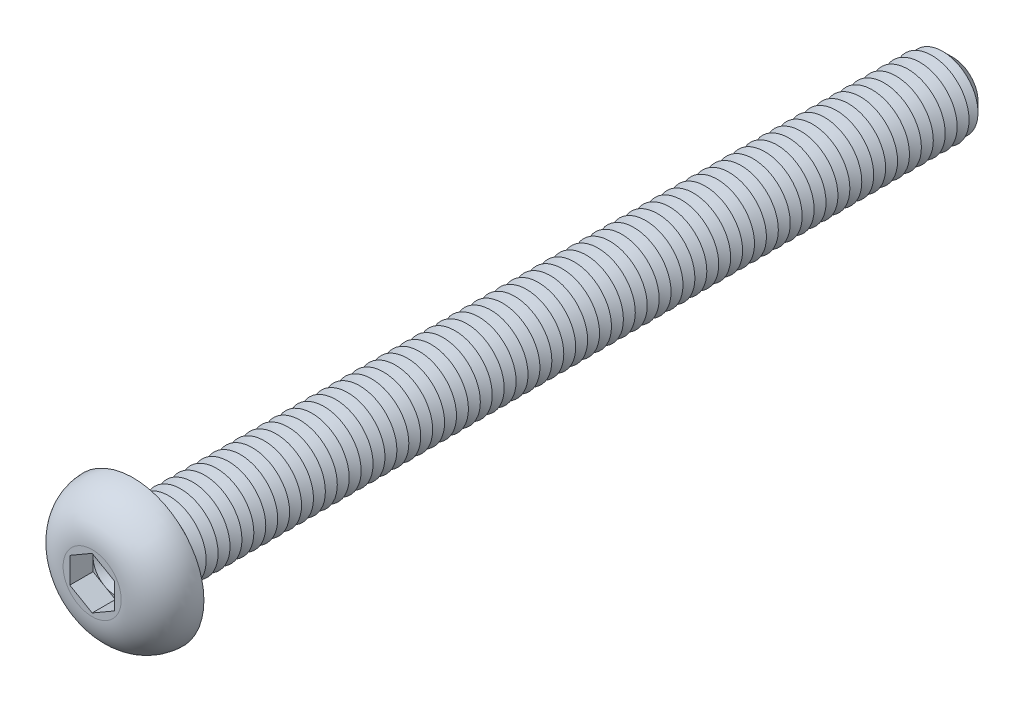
SolidWorks part; units mm, degrees
ref_plane "Front Plane" through (0, 0, 0) normal (0, 0, 1) x (1, 0, 0)
ref_plane "Top Plane" through (0, 0, 0) normal (0, 1, 0) x (1, 0, 0)
ref_plane "Right Plane" through (0, 0, 0) normal (1, 0, 0) x (0, 0, -1)
sketch "Sketch1" plane through (0, 0, 0) normal (1, 0, 0) x (0, 0, -1)
  line L0 (-47.9342, 0) -> (60.3146, 0) construction
sketch "Sketch2" plane through (0, 0, 0) normal (1, 0, 0) x (0, 0, -1)
  line L0 (0, 0) -> (-2.75, 0)
  line L1 (-47.9342, 0) -> (60.3146, 0) construction
  line L2 (-2.75, 0) -> (-2.75, 1.9504)
  line L3 (0, 4.75) -> (0, 0)
  arc A0 (-2.75, 1.9504) -> (0, 4.75) centre (0.05, 1.9504) cw
  dimension "D1" = 2.8
  dimension "D2" = 2.75
  dimension "D3" = 4.75
revolve "Revolve1" add sketch "Sketch2" angle 360 about L0
sketch "Sketch3" plane through (0, 0, 2.75) normal (0, 0, 1) x (1, 0, 0)
  line L1 (0, 1.7321) -> (-1.5, 0.866)
  line L2 (-1.5, 0.866) -> (-1.5, -0.866)
  line L3 (-1.5, -0.866) -> (0, -1.7321)
  line L4 (0, -1.7321) -> (1.5, -0.866)
  line L5 (1.5, -0.866) -> (1.5, 0.866)
  line L6 (1.5, 0.866) -> (0, 1.7321)
  circle A0 centre (0, 0) radius 1.5 construction
  dimension "D1" = 3
extrude "Cut-Extrude1" cut sketch "Sketch3" against normal blind 1.56
sketch "Sketch4" plane through (0, 0, 0) normal (0, 0, -1) x (-1, 0, 0)
  circle A0 centre (0, 0) radius 2.5
  dimension "D1" = 5
extrude "Boss-Extrude1" add sketch "Sketch4" along normal blind 55
chamfer "Chamfer1" distance 0.8 angle 45 1 edges at (-2.5, 0, -55)
sketch "Sketch5" plane through (0, 0, 0) normal (1, 0, 0) x (0, 0, -1)
  line L0 (0.8, 2.5) -> (1.6, 2.5)
  line L1 (54.2, 2.5) -> (0, 2.5) construction
  line L2 (1.6, 2.5) -> (1.2, 1.8072)
  line L3 (1.2, 1.8072) -> (0.8, 2.5)
  line L4 (0, -4.75) -> (0, 4.75) construction
  line L5 (54.2, 2.5) -> (0, 2.5) construction
  dimension "D1" = 0.8
  dimension "D2" = 0.8
revolve "Cut-Revolve1" cut sketch "Sketch5" angle 360 about L0
pattern_linear "LPattern1" count 67 spacing 0.8 along (0, 0, -1) of "Cut-Revolve1"
fillet "Fillet2" radius 0.4 1 edges at (2.5, 0, 0)
sketch "Sketch6" plane through (0, 0, 1.19) normal (0, 0, 1) x (1, 0, 0)
  line L0 (0, -1.7321) -> (1.5, -0.866) construction
  circle A0 centre (0, 0) radius 1.5
extrude "Cut-Extrude2" cut sketch "Sketch6" against normal through all draft 60
